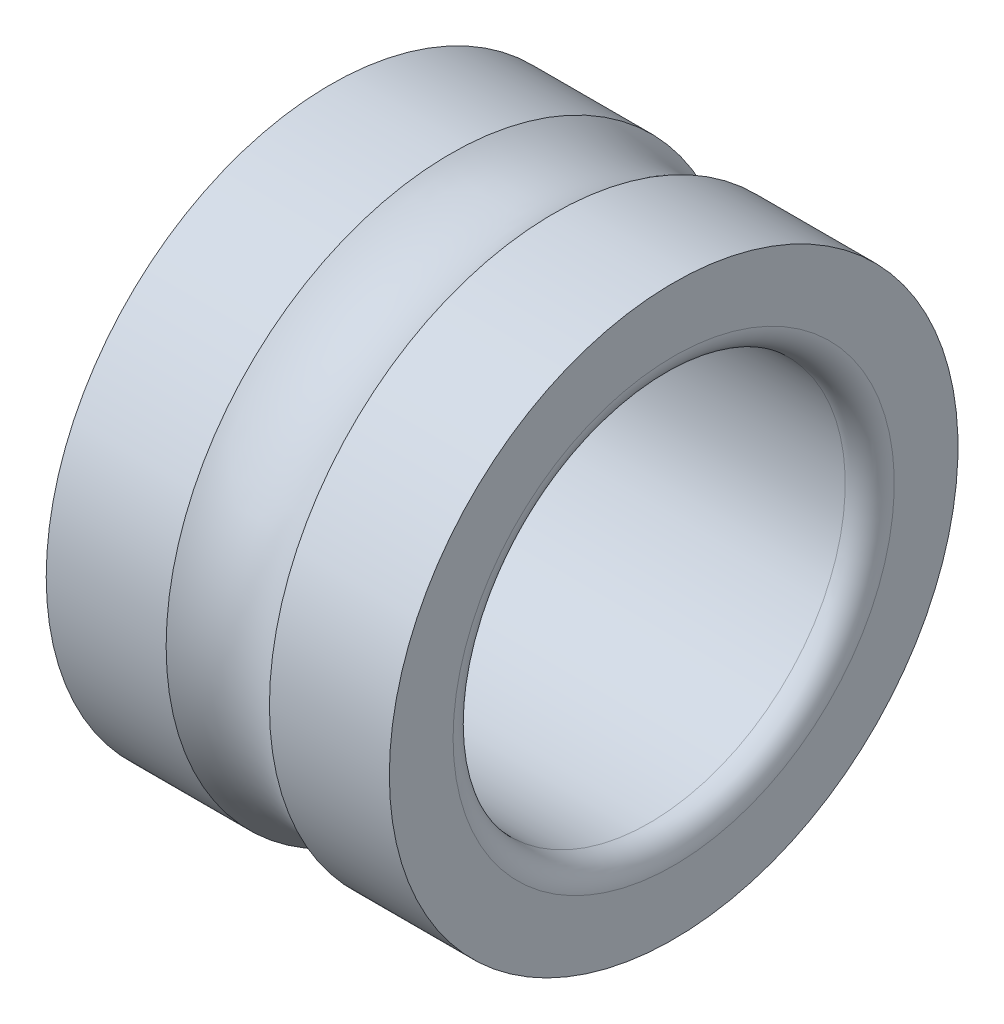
SolidWorks part; units mm, degrees
ref_plane "Face" through (0, 0, 0) normal (0, 0, 1) x (1, 0, 0)
ref_plane "Dessus" through (0, 0, 0) normal (0, 1, 0) x (1, 0, 0)
ref_plane "Droite" through (0, 0, 0) normal (1, 0, 0) x (0, 0, -1)
sketch "Esquisse1" plane through (0, 0, 0) normal (0, 0, 1) x (1, 0, 0)
  line L5 (-4.3709, 0) -> (4.0553, 0) construction
  line L7 (3.5, 4.5) -> (3.5, 5.8)
  line L8 (-3.5, 5.8) -> (-1.0536, 5.8)
  line L9 (-3.5, 4.5) -> (-3.5, 5.8)
  line L10 (-3, 4) -> (3, 4)
  line L11 (1.0536, 5.8) -> (3.5, 5.8)
  arc A0 (-3, 4) -> (-3.5, 4.5) centre (-3, 4.5) cw
  arc A1 (3.5, 4.5) -> (3, 4) centre (3, 4.5) cw
  arc A5 (1.0536, 5.8) -> (-1.0536, 5.8) centre (0, 7.5) cw
  dimension "D6" = 7
  dimension "D7" = 0.5
  dimension "D8" = 0.5
  dimension "D3" = 7.5
  dimension "D2" = 2
  dimension "D1" = 4
  dimension "D4" = 1.8
  dimension "D5" = 3.5
revolve "Base-Révolution" add sketch "Esquisse1" angle 360 about L5
